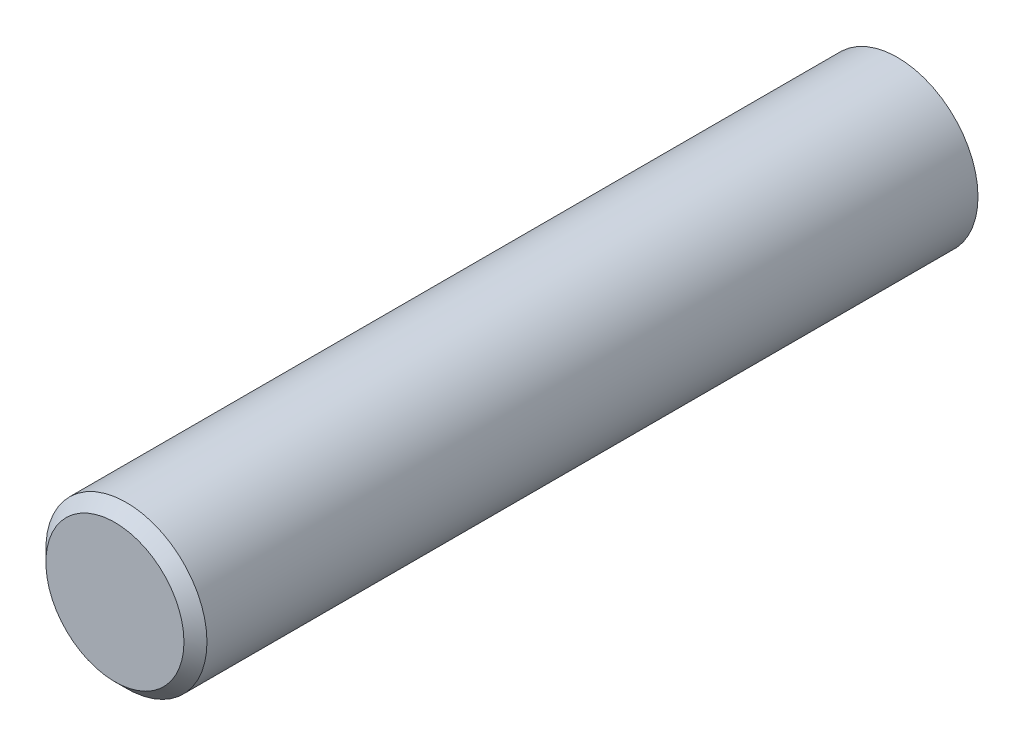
SolidWorks part; units mm, degrees
ref_plane "Plan de face" through (0, 0, 0) normal (0, 0, 1) x (1, 0, 0)
ref_plane "Plan de dessus" through (0, 0, 0) normal (0, 1, 0) x (1, 0, 0)
ref_plane "Plan de droite" through (0, 0, 0) normal (1, 0, 0) x (0, 0, -1)
sketch "Esquisse1" plane through (0, 0, 0) normal (0, 0, 1) x (1, 0, 0)
  circle A0 centre (0, 0) radius 3.5
  dimension "D1" = 7
extrude "Boss.-Extru.1" add sketch "Esquisse1" along normal blind 34
chamfer "Chanfrein1" distance 0.5 angle 45 1 edges at (3.5, 0, 34)
